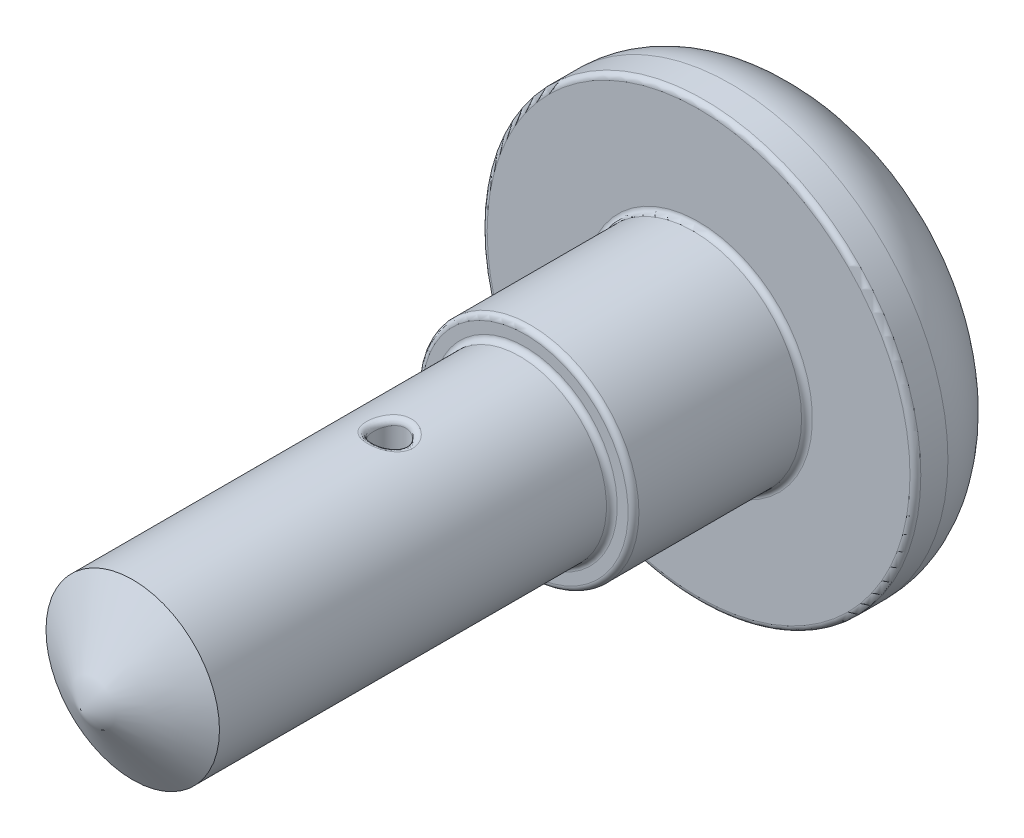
SolidWorks part; units mm, degrees
ref_plane "Спереди" through (0, 0, 0) normal (0, 0, 1) x (1, 0, 0)
ref_plane "Сверху" through (0, 0, 0) normal (0, 1, 0) x (1, 0, 0)
ref_plane "Справа" through (0, 0, 0) normal (1, 0, 0) x (0, 0, -1)
sketch "Эскиз1" plane through (0, 0, 0) normal (1, 0, 0) x (0, 0, -1)
  line L0 (0, 0) -> (28, 0)
  line L1 (28, 0) -> (28, 1.75)
  line L2 (28, 1.75) -> (35, 1.75)
  line L3 (28.5, 5) -> (20.5, 5)
  line L5 (20.5, 5) -> (20.5, 4)
  line L6 (20.5, 4) -> (2.4034, 4)
  line L7 (2.4034, 4) -> (0, 0)
  line L8 (28.5, 5) -> (28.5, 10)
  line L9 (28.5, 10) -> (30, 10)
  ellipse E0 centre (30, 1.75) end of major axis (30, 10) minor radius 5 (35, 1.75) -> (30, 10) ccw
  dimension "D1" = 4
  dimension "D2" = 5
  dimension "D3" = 59
  dimension "D4" = 10
  dimension "D5" = 6.5
  dimension "D6" = 1.75
  dimension "D7" = 1.5
  dimension "D8" = 8
  dimension "D9" = 20.5
  dimension "D10" = 7
revolve "Повернуть1" add sketch "Эскиз1" angle 360 about L0
sketch "Эскиз2" plane through (0, 0, 0) normal (0, 1, 0) x (1, 0, 0)
  line L0 (-4, 20.5) -> (4, 20.5) construction
  circle A0 centre (0, 14.25) radius 0.75
  dimension "D1" = 1.5
  dimension "D2" = 6.25
extrude "Вырез-Вытянуть1" cut sketch "Эскиз2" against normal mid plane 10
fillet "Скругление2" radius 0.25 8 edges at (-0.1578, -3.9969, -14.9832) (0.1578, 3.9969, -14.9832) (10, 0, -28.5) (1.75, 0, -28) (1.75, 0, -35) (5, 0, -28.5) (5, 0, -20.5) (4, 0, -20.5)
